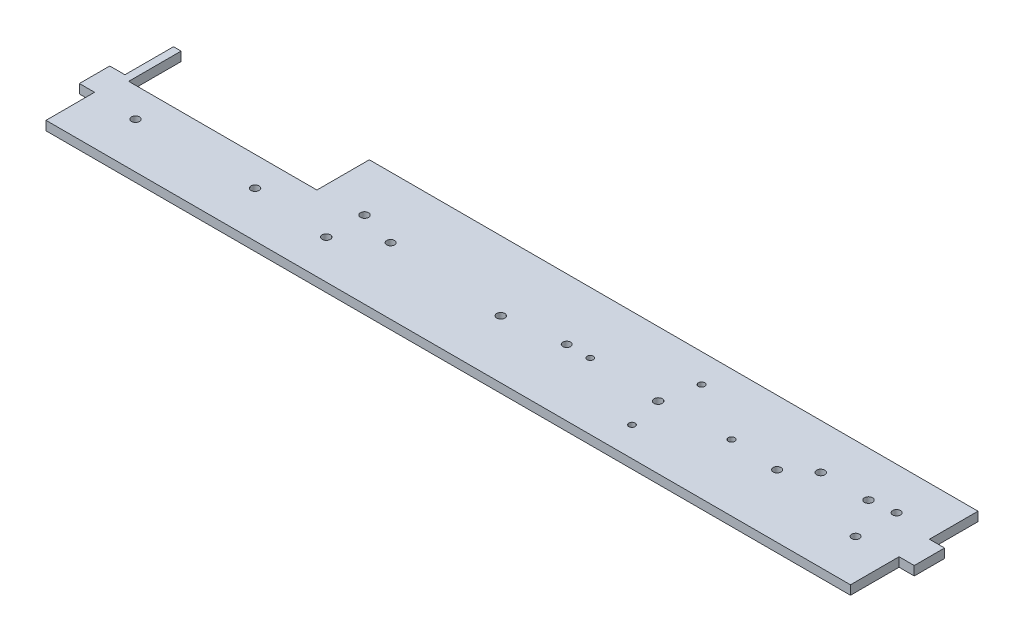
SolidWorks part; units mm, degrees
ref_plane "Front Plane" through (0, 0, 0) normal (0, 0, 1) x (1, 0, 0)
ref_plane "Top Plane" through (0, 0, 0) normal (0, 1, 0) x (1, 0, 0)
ref_plane "Right Plane" through (0, 0, 0) normal (1, 0, 0) x (0, 0, -1)
inserted part "NewAvionicsBay2<1>@Mudd III Medium Assembly/AvionicsMainBoard<1>@NewAvionicsBay2"
